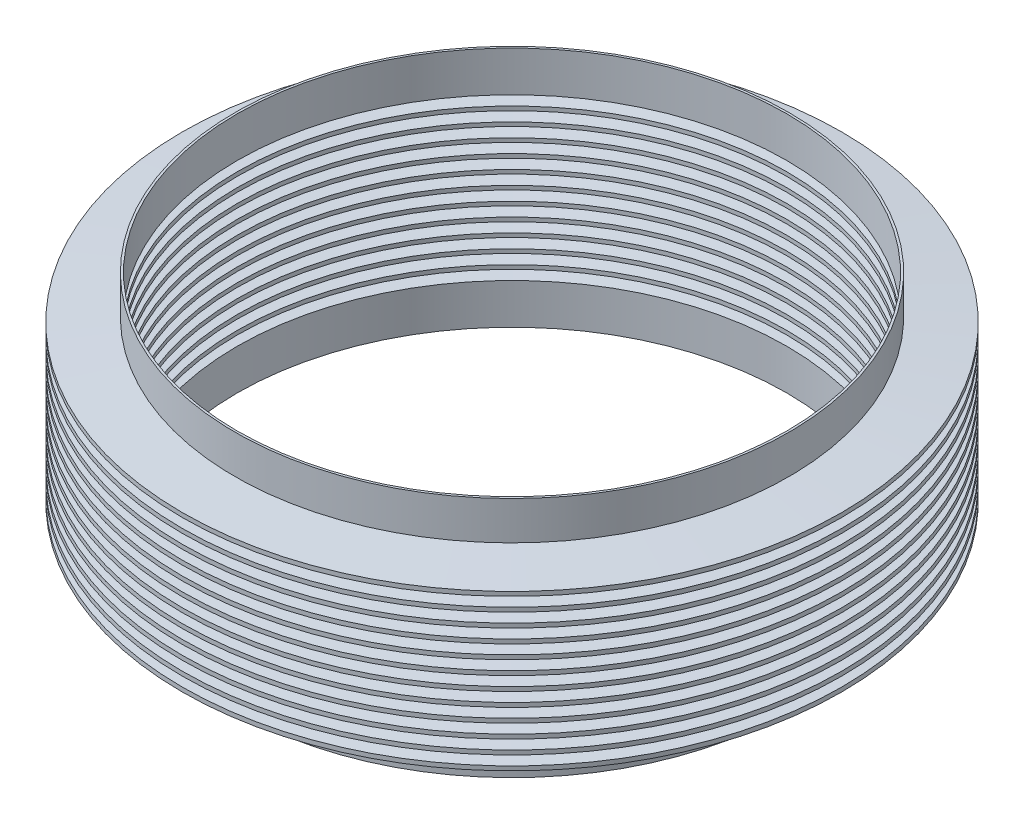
SolidWorks part; units mm, degrees
ref_plane "Front Plane" through (0, 0, 0) normal (0, 0, 1) x (1, 0, 0)
ref_plane "Top Plane" through (0, 0, 0) normal (0, 1, 0) x (1, 0, 0)
ref_plane "Right Plane" through (0, 0, 0) normal (1, 0, 0) x (0, 0, -1)
sketch "Sketch1" plane through (0, 0, 0) normal (0, 0, 1) x (1, 0, 0)
  line L0 (0, 0) -> (0, 92.7377) construction
  line L1 (-128.016, 0) -> (-127, 0)
  line L2 (-128.016, 43.18) -> (-102.0279, 43.18) construction
  line L3 (-152.0713, 65.405) -> (-109.151, 65.405) construction
  line L4 (-128.016, 0) -> (-128.016, 17.78)
  line L5 (-128.016, 17.78) -> (-152.4, 19.9644)
  line L6 (-127, 18.7091) -> (-127, 0)
  line L7 (-127, 18.7091) -> (-152.0713, 20.955)
  line L8 (-127, 23.2009) -> (-152.0713, 20.955)
  line L9 (-128.016, 24.13) -> (-152.4, 21.9456)
  line L10 (-128.016, 24.13) -> (-173.8883, 24.13) construction
  line L11 (-152.4, 26.3144) -> (-152.4, 28.2956)
  line L12 (-128.016, 30.48) -> (-152.4, 28.2956)
  line L13 (-127, 29.5509) -> (-152.0713, 27.305)
  line L14 (-152.0713, 27.305) -> (-109.151, 27.305) construction
  line L15 (-127, 25.0591) -> (-152.0713, 27.305)
  line L16 (-128.016, 24.13) -> (-152.4, 26.3144)
  line L17 (-128.016, 30.48) -> (-159.6927, 30.48) construction
  line L18 (-152.4, 21.9456) -> (-152.4, 19.9644)
  line L19 (-127, 35.9009) -> (-127, 37.7591)
  line L20 (-152.4, 34.6456) -> (-152.4, 32.6644)
  line L21 (-128.016, 36.83) -> (-152.4, 34.6456)
  line L22 (-127, 35.9009) -> (-152.0713, 33.655)
  line L23 (-127, 31.4091) -> (-152.0713, 33.655)
  line L24 (-128.016, 30.48) -> (-152.4, 32.6644)
  line L25 (-127, 25.0591) -> (-127, 23.2009)
  line L26 (-128.016, 36.83) -> (-159.5474, 36.83) construction
  line L27 (-128.016, 49.53) -> (-159.5474, 49.53) construction
  line L28 (-128.016, 55.88) -> (-159.6927, 55.88) construction
  line L29 (-152.0713, 59.055) -> (-109.151, 59.055) construction
  line L31 (-127, 42.2509) -> (-152.0713, 40.005)
  line L32 (-152.0713, 20.955) -> (-109.151, 20.955) construction
  line L33 (-127, 37.7591) -> (-152.0713, 40.005)
  line L34 (-152.4, 39.0144) -> (-152.4, 40.9956)
  line L35 (-128.016, 43.18) -> (-152.4, 40.9956)
  line L36 (-128.016, 36.83) -> (-152.4, 39.0144)
  line L37 (-127, 31.4091) -> (-127, 29.5509)
  line L38 (-128.016, 62.23) -> (-173.8883, 62.23) construction
  line L39 (-127, 54.9509) -> (-127, 56.8091)
  line L40 (-128.016, 49.53) -> (-152.4, 47.3456)
  line L41 (-128.016, 43.18) -> (-152.4, 45.3644)
  line L42 (-152.4, 47.3456) -> (-152.4, 45.3644)
  line L43 (-127, 48.6009) -> (-152.0713, 46.355)
  line L44 (-127, 44.1091) -> (-152.0713, 46.355)
  line L45 (-127, 61.3009) -> (-127, 63.1591)
  line L46 (-128.016, 55.88) -> (-152.4, 53.6956)
  line L47 (-127, 54.9509) -> (-152.0713, 52.705)
  line L48 (-127, 50.4591) -> (-152.0713, 52.705)
  line L49 (-128.016, 49.53) -> (-152.4, 51.7144)
  line L50 (-152.4, 51.7144) -> (-152.4, 53.6956)
  line L51 (-127, 50.4591) -> (-127, 48.6009)
  line L52 (-152.4, 64.4144) -> (-152.4, 66.3956)
  line L53 (-128.016, 62.23) -> (-152.4, 60.0456)
  line L54 (-127, 61.3009) -> (-152.0713, 59.055)
  line L55 (-127, 56.8091) -> (-152.0713, 59.055)
  line L56 (-128.016, 55.88) -> (-152.4, 58.0644)
  line L57 (-152.4, 60.0456) -> (-152.4, 58.0644)
  line L58 (-128.016, 62.23) -> (-152.4, 64.4144)
  line L59 (-127, 63.1591) -> (-152.0713, 65.405)
  line L60 (-127, 67.6509) -> (-152.0713, 65.405)
  line L61 (-128.016, 68.58) -> (-152.4, 66.3956)
  line L62 (-128.016, 68.58) -> (-114.1607, 68.58) construction
  line L63 (-128.016, 74.93) -> (-173.8883, 74.93) construction
  line L64 (-152.0713, 78.105) -> (-109.151, 78.105) construction
  line L65 (-128.016, 81.28) -> (-159.6927, 81.28) construction
  line L66 (-128.016, 87.63) -> (-159.5474, 87.63) construction
  line L67 (-152.0713, 71.755) -> (-109.151, 71.755) construction
  line L68 (-128.016, 68.58) -> (-152.4, 70.7644)
  line L69 (-127, 69.5091) -> (-152.0713, 71.755)
  line L70 (-127, 74.0009) -> (-152.0713, 71.755)
  line L71 (-128.016, 74.93) -> (-152.4, 72.7456)
  line L72 (-152.4, 77.1144) -> (-152.4, 79.0956)
  line L73 (-128.016, 81.28) -> (-152.4, 79.0956)
  line L74 (-127, 80.3509) -> (-152.0713, 78.105)
  line L75 (-127, 75.8591) -> (-152.0713, 78.105)
  line L76 (-128.016, 74.93) -> (-152.4, 77.1144)
  line L77 (-152.4, 72.7456) -> (-152.4, 70.7644)
  line L78 (-127, 86.7009) -> (-127, 88.5591)
  line L79 (-152.4, 85.4456) -> (-152.4, 83.4644)
  line L80 (-128.016, 87.63) -> (-152.4, 85.4456)
  line L81 (-127, 86.7009) -> (-152.0713, 84.455)
  line L82 (-127, 82.2091) -> (-152.0713, 84.455)
  line L83 (-128.016, 81.28) -> (-152.4, 83.4644)
  line L84 (-127, 75.8591) -> (-127, 74.0009)
  line L85 (-127, 93.0509) -> (-152.0713, 90.805)
  line L86 (-127, 88.5591) -> (-152.0713, 90.805)
  line L87 (-152.4, 89.8144) -> (-152.4, 91.7956)
  line L88 (-128.016, 93.98) -> (-152.4, 91.7956)
  line L89 (-128.016, 87.63) -> (-152.4, 89.8144)
  line L90 (-127, 82.2091) -> (-127, 80.3509)
  line L91 (-127, 69.5091) -> (-127, 67.6509)
  line L92 (-127, 44.1091) -> (-127, 42.2509)
  line L93 (-128.016, 93.98) -> (-128.016, 111.76)
  line L94 (-128.016, 111.76) -> (-127, 111.76)
  line L95 (-127, 111.76) -> (-127, 93.0509)
  dimension "D2" = 254
  dimension "D3" = 1.016
  dimension "D4" = 17.78
  dimension "D5" = 304.8
  dimension "D6" = 1.016
  dimension "D7" = 76.2
  dimension "D8" = 1.016
  dimension "D9" = 17.78
  dimension "D14" = 1.9812
revolve "Revolve1" add sketch "Sketch1" angle 360 about L0
sketch "Sketch3" plane through (0, 0, 0) normal (0, 0, 1) x (1, 0, 0)
  line L630 (-127, 18.7091) -> (0, 18.7091)
  line L631 (127, 18.7091) -> (-127, 18.7091) construction
  line L632 (0, 18.7091) -> (0, 93.0509)
  line L633 (127, 93.0509) -> (-127, 93.0509) construction
  line L634 (0, 93.0509) -> (-127, 93.0509)
  line L635 (0, 18.7091) -> (0, 433.5908) construction
  line L665 (-152.0713, 20.955) -> (-127, 18.7091)
  line L666 (-127, 23.2009) -> (-152.0713, 20.955)
  line L667 (-127, 25.0591) -> (-127, 23.2009)
  line L668 (-152.0713, 27.305) -> (-127, 25.0591)
  line L669 (-127, 29.5509) -> (-152.0713, 27.305)
  line L670 (-127, 31.4091) -> (-127, 29.5509)
  line L671 (-152.0713, 33.655) -> (-127, 31.4091)
  line L672 (-127, 35.9009) -> (-152.0713, 33.655)
  line L673 (-127, 37.7591) -> (-127, 35.9009)
  line L674 (-152.0713, 40.005) -> (-127, 37.7591)
  line L675 (-127, 42.2509) -> (-152.0713, 40.005)
  line L676 (-127, 44.1091) -> (-127, 42.2509)
  line L677 (-152.0713, 46.355) -> (-127, 44.1091)
  line L678 (-127, 48.6009) -> (-152.0713, 46.355)
  line L679 (-127, 50.4591) -> (-127, 48.6009)
  line L680 (-152.0713, 52.705) -> (-127, 50.4591)
  line L681 (-127, 54.9509) -> (-152.0713, 52.705)
  line L682 (-127, 56.8091) -> (-127, 54.9509)
  line L683 (-152.0713, 59.055) -> (-127, 56.8091)
  line L684 (-127, 61.3009) -> (-152.0713, 59.055)
  line L685 (-127, 63.1591) -> (-127, 61.3009)
  line L686 (-152.0713, 65.405) -> (-127, 63.1591)
  line L687 (-127, 67.6509) -> (-152.0713, 65.405)
  line L688 (-127, 69.5091) -> (-127, 67.6509)
  line L689 (-152.0713, 71.755) -> (-127, 69.5091)
  line L690 (-127, 74.0009) -> (-152.0713, 71.755)
  line L691 (-127, 75.8591) -> (-127, 74.0009)
  line L692 (-152.0713, 78.105) -> (-127, 75.8591)
  line L693 (-127, 80.3509) -> (-152.0713, 78.105)
  line L694 (-127, 82.2091) -> (-127, 80.3509)
  line L695 (-152.0713, 84.455) -> (-127, 82.2091)
  line L696 (-127, 86.7009) -> (-152.0713, 84.455)
  line L697 (-127, 88.5591) -> (-127, 86.7009)
  line L698 (-152.0713, 90.805) -> (-127, 88.5591)
  line L699 (-127, 93.0509) -> (-152.0713, 90.805)
  line L700 (-152.0713, 20.955) -> (-127, 18.7091)
  line L701 (-127, 23.2009) -> (-152.0713, 20.955)
  line L702 (-127, 25.0591) -> (-127, 23.2009)
  line L703 (-152.0713, 27.305) -> (-127, 25.0591)
  line L704 (-127, 29.5509) -> (-152.0713, 27.305)
  line L705 (-127, 31.4091) -> (-127, 29.5509)
  line L706 (-152.0713, 33.655) -> (-127, 31.4091)
  line L707 (-127, 35.9009) -> (-152.0713, 33.655)
  line L708 (-127, 37.7591) -> (-127, 35.9009)
  line L709 (-152.0713, 40.005) -> (-127, 37.7591)
  line L710 (-127, 42.2509) -> (-152.0713, 40.005)
  line L711 (-127, 44.1091) -> (-127, 42.2509)
  line L712 (-152.0713, 46.355) -> (-127, 44.1091)
  line L713 (-127, 48.6009) -> (-152.0713, 46.355)
  line L714 (-127, 50.4591) -> (-127, 48.6009)
  line L715 (-152.0713, 52.705) -> (-127, 50.4591)
  line L716 (-127, 54.9509) -> (-152.0713, 52.705)
  line L717 (-127, 56.8091) -> (-127, 54.9509)
  line L718 (-152.0713, 59.055) -> (-127, 56.8091)
  line L719 (-127, 61.3009) -> (-152.0713, 59.055)
  line L720 (-127, 63.1591) -> (-127, 61.3009)
  line L721 (-152.0713, 65.405) -> (-127, 63.1591)
  line L722 (-127, 67.6509) -> (-152.0713, 65.405)
  line L723 (-127, 69.5091) -> (-127, 67.6509)
  line L724 (-152.0713, 71.755) -> (-127, 69.5091)
  line L725 (-127, 74.0009) -> (-152.0713, 71.755)
  line L726 (-127, 75.8591) -> (-127, 74.0009)
  line L727 (-152.0713, 78.105) -> (-127, 75.8591)
  line L728 (-127, 80.3509) -> (-152.0713, 78.105)
  line L729 (-127, 82.2091) -> (-127, 80.3509)
  line L730 (-152.0713, 84.455) -> (-127, 82.2091)
  line L731 (-127, 86.7009) -> (-152.0713, 84.455)
  line L732 (-127, 88.5591) -> (-127, 86.7009)
  line L733 (-152.0713, 90.805) -> (-127, 88.5591)
  line L734 (-127, 93.0509) -> (-152.0713, 90.805)
  dimension "D1" = 0
revolve "Revolve2" [suppressed] add sketch "Sketch3" angle 360 about L635
